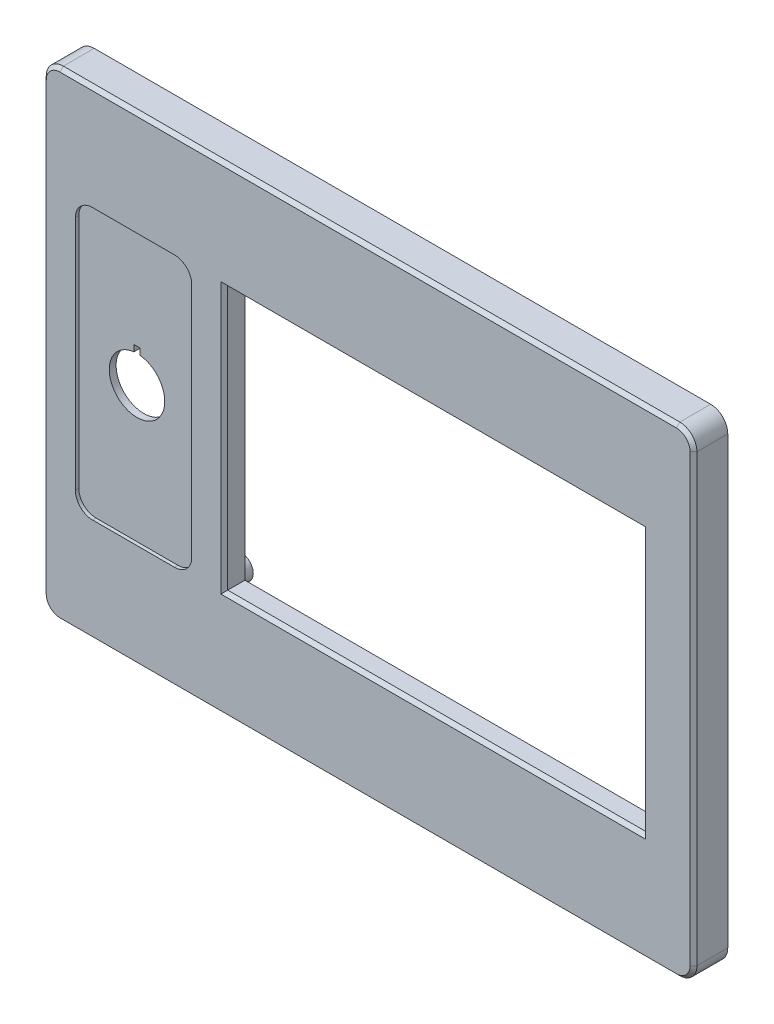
SolidWorks part; units mm, degrees
ref_plane "Front Plane" through (0, 0, 0) normal (0, 0, 1) x (1, 0, 0)
ref_plane "Top Plane" through (0, 0, 0) normal (0, 1, 0) x (1, 0, 0)
ref_plane "Right Plane" through (0, 0, 0) normal (1, 0, 0) x (0, 0, -1)
sketch "Sketch1" plane through (0, 0, 0) normal (0, 0, 1) x (1, 0, 0)
  line L0 (-90, -70) -> (90, -70) construction
  line L1 (95, -65) -> (95, 65) construction
  line L2 (90, 70) -> (-90, 70) construction
  line L3 (-95, 65) -> (-95, -65) construction
  line L4 (-90, -70) -> (90, -70)
  line L5 (95, -65) -> (95, 65)
  line L6 (90, 70) -> (-90, 70)
  line L7 (-95, 65) -> (-95, -65)
  line L8 (92, -65) -> (92, 65)
  line L9 (90, 67) -> (-90, 67)
  line L10 (-92, 65) -> (-92, -65)
  line L11 (-90, -67) -> (90, -67)
  arc A0 (-95, -65) -> (-90, -70) centre (-90, -65) ccw construction
  arc A1 (90, -70) -> (95, -65) centre (90, -65) ccw construction
  arc A2 (95, 65) -> (90, 70) centre (90, 65) ccw construction
  arc A3 (-90, 70) -> (-95, 65) centre (-90, 65) ccw construction
  arc A4 (-95, -65) -> (-90, -70) centre (-90, -65) ccw
  arc A5 (90, -70) -> (95, -65) centre (90, -65) ccw
  arc A6 (95, 65) -> (90, 70) centre (90, 65) ccw
  arc A7 (-90, 70) -> (-95, 65) centre (-90, 65) ccw
  arc A8 (92, 65) -> (90, 67) centre (90, 65) ccw
  arc A9 (-90, 67) -> (-92, 65) centre (-90, 65) ccw
  arc A10 (-92, -65) -> (-90, -67) centre (-90, -65) ccw
  arc A11 (90, -67) -> (92, -65) centre (90, -65) ccw
  dimension "D1" = 3
extrude "Boss-Extrude1" add sketch "Sketch1" along normal blind 10
sketch "Sketch2" plane through (0, 0, 10) normal (0, 0, 1) x (1, 0, 0)
  line L0 (95, -65) -> (95, 65) construction
  line L1 (-90, -70) -> (90, -70) construction
  line L2 (-95, 65) -> (-95, -65) construction
  line L3 (90, 70) -> (-90, 70) construction
  line L4 (95, -65) -> (95, 65)
  line L5 (-90, -70) -> (90, -70)
  line L6 (-95, 65) -> (-95, -65)
  line L7 (90, 70) -> (-90, 70)
  arc A0 (95, 65) -> (90, 70) centre (90, 65) ccw construction
  arc A1 (90, -70) -> (95, -65) centre (90, -65) ccw construction
  arc A2 (-95, -65) -> (-90, -70) centre (-90, -65) ccw construction
  arc A3 (-90, 70) -> (-95, 65) centre (-90, 65) ccw construction
  arc A4 (95, 65) -> (90, 70) centre (90, 65) ccw
  arc A5 (90, -70) -> (95, -65) centre (90, -65) ccw
  arc A6 (-95, -65) -> (-90, -70) centre (-90, -65) ccw
  arc A7 (-90, 70) -> (-95, 65) centre (-90, 65) ccw
extrude "Boss-Extrude2" add sketch "Sketch2" against normal blind 3
sketch "Sketch3" plane through (0, 0, 10) normal (0, 0, 1) x (1, 0, 0)
  line L0 (-95, 0) -> (95, 0) construction
  line L1 (-95, 65) -> (-95, -65) construction
  line L2 (95, -65) -> (95, 65) construction
  line L3 (-68.5, 0) -> (-68.5, 10.1635) construction
  line L4 (-46.05, 38.55) -> (84.05, 38.55) construction
  line L5 (-46.05, 38.55) -> (-46.05, -38.55) construction
  line L6 (-46.05, -38.55) -> (84.05, -38.55) construction
  line L7 (84.05, 38.55) -> (84.05, -38.55) construction
  line L8 (-46.05, 38.55) -> (84.05, -38.55) construction
  line L9 (-46.05, -38.55) -> (84.05, 38.55) construction
  line L10 (-49.5, 42) -> (87.5, 42) construction
  line L11 (-49.5, 42) -> (-49.5, -42) construction
  line L12 (-49.5, -42) -> (87.5, -42) construction
  line L13 (87.5, 42) -> (87.5, -42) construction
  line L14 (-49.5, 42) -> (87.5, -42) construction
  line L15 (-49.5, -42) -> (87.5, 42) construction
  line L16 (-42, 38.5) -> (80, 38.5)
  line L17 (-42, 38.5) -> (-42, -38.5)
  line L18 (-42, -38.5) -> (80, -38.5)
  line L19 (80, 38.5) -> (80, -38.5)
  line L20 (-42, 38.5) -> (80, -38.5) construction
  line L21 (-42, -38.5) -> (80, 38.5) construction
  line L22 (-69.4, 9.9) -> (-67.6, 9.9)
  line L23 (-69.4, 4.6101) -> (-67.6, 4.6101) construction
  line L24 (-69.4, 4.6101) -> (-69.4, 9.9) construction
  line L25 (-69.4, 9.9) -> (-67.6, 9.9) construction
  line L26 (-67.6, 4.6101) -> (-67.6, 9.9) construction
  line L27 (-69.4, 4.6101) -> (-67.6, 9.9) construction
  line L28 (-69.4, 9.9) -> (-67.6, 4.6101) construction
  line L29 (-67.6, 9.9) -> (-67.6, 8.0498)
  line L30 (-69.4, 9.9) -> (-69.4, 8.0498)
  arc A5 (-69.4, 8.0498) -> (-67.6, 8.0498) centre (-68.5, 0) ccw
  point P6 (19, 0)
  point P11 (19, 0)
  point P12 (19, 0)
  point P23 (-68.5, 7.255)
  point P29 (-68.5, -8.1)
  dimension "D7" = 16.2
  dimension "D8" = 26.5
  dimension "D9" = 18
  dimension "D10" = 1.8
  dimension "D1" = 130.1
  dimension "D2" = 77.1
  dimension "D3" = 137
  dimension "D4" = 84
  dimension "D5" = 77
  dimension "D6" = 122
  dimension "D11" = 114
extrude "Cut-Extrude1" cut sketch "Sketch3" against normal blind 3
sketch "Sketch4" plane through (0, 0, 7) normal (0, 0, -1) x (-1, 0, 0)
  circle A0 centre (-84.05, 38.55) radius 3.5
  circle A1 centre (-84.05, 38.55) radius 2
  circle A2 centre (46.05, 38.55) radius 3.5
  circle A3 centre (46.05, 38.55) radius 2
  circle A4 centre (46.05, -38.55) radius 3.5
  circle A5 centre (46.05, -38.55) radius 2
  circle A6 centre (-84.05, -38.55) radius 3.5
  circle A7 centre (-84.05, -38.55) radius 2
  dimension "D1" = 4
  dimension "D2" = 7
  dimension "D3" = 7
  dimension "D4" = 4
  dimension "D5" = 7
  dimension "D6" = 4
  dimension "D7" = 7
  dimension "D8" = 4
extrude "LCD Standoffs" add sketch "Sketch4" along normal blind 6
chamfer "Chamfer1" distance 1 angle 45 8 edges at (-95, 0, 10) (-93.5355, -68.5355, 10) (-93.5355, 68.5355, 10) (0, -70, 10) (0, 70, 10) (93.5355, -68.5355, 10) (93.5355, 68.5355, 10) (95, 0, 10)
sketch "Sketch5" plane through (0, 0, 7) normal (0, 0, -1) x (-1, 0, 0)
  line L0 (75, 67) -> (92, 50)
  line L3 (92, -50) -> (75, -67)
  line L4 (-90, -67) -> (90, -67)
  line L5 (92, -65) -> (92, 65)
  line L6 (90, 67) -> (-90, 67)
  line L7 (-92, 65) -> (-92, -65)
  line L8 (-90, -67) -> (-75, -67)
  line L9 (92, -65) -> (92, -50)
  line L10 (90, 67) -> (75, 67)
  line L11 (-92, 65) -> (-92, 50)
  line L13 (-92, -50) -> (-75, -67)
  line L15 (-75, 67) -> (-92, 50)
  line L16 (-92, -50) -> (-92, -65)
  line L17 (-75, 67) -> (-90, 67)
  line L18 (92, 50) -> (92, 65)
  line L19 (75, -67) -> (90, -67)
  line L20 (90, -70) -> (-90, -70) construction
  line L21 (-95, -65) -> (-95, 65) construction
  line L22 (95, 65) -> (95, -65) construction
  line L23 (-90, 70) -> (90, 70) construction
  arc A5 (-92, -65) -> (-90, -67) centre (-90, -65) ccw
  arc A6 (90, -67) -> (92, -65) centre (90, -65) ccw
  arc A7 (92, 65) -> (90, 67) centre (90, 65) ccw
  arc A8 (-90, 67) -> (-92, 65) centre (-90, 65) ccw
  arc A9 (-92, -65) -> (-90, -67) centre (-90, -65) ccw
  arc A10 (90, -67) -> (92, -65) centre (90, -65) ccw
  arc A11 (92, 65) -> (90, 67) centre (90, 65) ccw
  arc A12 (-90, 67) -> (-92, 65) centre (-90, 65) ccw
  dimension "D1" = 0
  dimension "D2" = 20
  dimension "D3" = 20
  dimension "D4" = 20
  dimension "D5" = 20
  dimension "D6" = 20
  dimension "D7" = 20
  dimension "D8" = 20
  dimension "D9" = 20
extrude "Boss-Extrude4" add sketch "Sketch5" along normal up to vertex (7 mm away)
sketch "Sketch6" plane through (0, 0, 0) normal (0, 0, -1) x (-1, 0, 0)
  line L0 (-93.5355, 68.5355) -> (-83.5, 58.5) construction
  line L1 (-92, 50) -> (-75, 67) construction
  line L2 (83.5, 58.5) -> (93.5355, 68.5355) construction
  line L3 (75, 67) -> (92, 50) construction
  line L4 (83.5, -58.5) -> (93.5355, -68.5355) construction
  line L5 (92, -50) -> (75, -67) construction
  line L6 (-93.5355, -68.5355) -> (-83.5, -58.5) construction
  line L7 (-75, -67) -> (-92, -50) construction
  circle A0 centre (89.5167, -64.5167) radius 2.85
  circle A1 centre (-89.5167, -64.5167) radius 2.85
  circle A2 centre (-89.5167, 64.5167) radius 2.85
  circle A3 centre (89.5167, 64.5167) radius 2.85
  arc A4 (-90, 70) -> (-95, 65) centre (-90, 65) ccw construction
  arc A5 (95, 65) -> (90, 70) centre (90, 65) ccw construction
  arc A6 (90, -70) -> (95, -65) centre (90, -65) ccw construction
  arc A7 (-95, -65) -> (-90, -70) centre (-90, -65) ccw construction
  dimension "D1" = 5.7
  dimension "D2" = 5.7
  dimension "D3" = 5.7
  dimension "D4" = 5.7
extrude "Cut-Extrude2" cut sketch "Sketch6" against normal blind 6.5
chamfer "LCD chamfer" distance 1 angle 45 4 edges at (19, 38.5, 10) (80, 0, 10) (19, -38.5, 10) (-42, 0, 10)
sketch "Sketch9" plane through (0, 0, 7) normal (0, 0, -1) x (-1, 0, 0)
  line L0 (-80, 38.5) -> (-80, -38.5) construction
  line L1 (42, 38.5) -> (-80, 38.5) construction
  line L2 (42, 38.5) -> (42, -38.5) construction
  line L3 (42, -38.5) -> (-80, -38.5) construction
  line L4 (-80, 38.5) -> (-80, -38.5)
  line L5 (42, 38.5) -> (-80, 38.5)
  line L6 (42, 38.5) -> (42, -38.5)
  line L7 (42, -38.5) -> (-80, -38.5)
  line L8 (44, -40.5) -> (-82, -40.5)
  line L9 (-82, 40.5) -> (-82, -40.5)
  line L10 (44, 40.5) -> (-82, 40.5)
  line L11 (44, 40.5) -> (44, -40.5)
  dimension "D1" = 2
extrude "Boss-Extrude6" add sketch "Sketch9" along normal blind 3
sketch "Sketch10" plane through (0, 0, 0) normal (0, 0, -1) x (-1, 0, 0)
  line L0 (75, 67) -> (92, 50) construction
  line L1 (92, 50) -> (92, -50) construction
  line L2 (92, -50) -> (75, -67) construction
  line L3 (75, -67) -> (-75, -67) construction
  line L4 (-75, -67) -> (-92, -50) construction
  line L5 (-92, -50) -> (-92, 50) construction
  line L6 (-75, 67) -> (75, 67) construction
  line L7 (-92, 50) -> (-75, 67) construction
  line L8 (75, 67) -> (92, 50)
  line L9 (92, 50) -> (92, -50)
  line L10 (92, -50) -> (75, -67)
  line L11 (75, -67) -> (-75, -67)
  line L12 (-75, -67) -> (-92, -50)
  line L13 (-92, -50) -> (-92, 50)
  line L14 (-75, 67) -> (75, 67)
  line L15 (-92, 50) -> (-75, 67)
  line L17 (93.65, 50.6835) -> (93.65, -50.6835)
  line L19 (75.6835, -68.65) -> (-75.6835, -68.65)
  line L21 (-93.65, -50.6835) -> (-93.65, 50.6835)
  line L23 (-75.6835, 68.65) -> (75.6835, 68.65)
  line L24 (-93.65, 50.6835) -> (-75.6835, 68.65) construction
  line L25 (-75.6835, -68.65) -> (-93.65, -50.6835) construction
  line L26 (93.65, -50.6835) -> (75.6835, -68.65) construction
  line L27 (75.6835, 68.65) -> (93.65, 50.6835) construction
  line L28 (75.6835, 68.65) -> (79.7542, 68.65)
  line L29 (79.7542, 68.65) -> (93.65, 54.7542)
  line L30 (93.65, 54.7542) -> (93.65, 50.6835)
  line L31 (-75.6835, 68.65) -> (-79.7542, 68.65)
  line L32 (-79.7542, 68.65) -> (-93.65, 54.7542)
  line L33 (-93.65, 54.7542) -> (-93.65, 50.6835)
  line L34 (-93.65, -50.6835) -> (-93.65, -54.7542)
  line L35 (-93.65, -54.7542) -> (-79.7542, -68.65)
  line L36 (-79.7542, -68.65) -> (-75.6835, -68.65)
  line L37 (93.65, -50.6835) -> (93.65, -54.7542)
  line L38 (75.6835, -68.65) -> (79.7542, -68.65)
  line L39 (79.7542, -68.65) -> (93.65, -54.7542)
  line L40 (-93.5, 54.6213) -> (-79.6213, 68.5) construction
  line L41 (79.6213, 68.5) -> (93.5, 54.6213) construction
  line L44 (93.5, -54.6213) -> (79.6213, -68.5) construction
  line L45 (-79.6213, -68.5) -> (-93.5, -54.6213) construction
  dimension "D2" = 0.2
  dimension "D3" = 0.2
  dimension "D4" = 0.2
  dimension "D5" = 0.2
  dimension "D1" = 1.65
extrude "Cut-Extrude4" cut sketch "Sketch10" against normal blind 1.6
sketch "Sketch11" plane through (0, 0, 10) normal (0, 0, 1) x (1, 0, 0)
  line L0 (81, -39.5) -> (-43, -39.5) construction
  line L1 (-80.4842, 39.5) -> (-56.5158, 39.5)
  line L2 (-85.4842, 34.5) -> (-85.4842, -34.5)
  line L3 (-80.4842, -39.5) -> (-56.5158, -39.5)
  line L4 (-51.5158, 34.5) -> (-51.5158, -34.5)
  line L5 (-85.4842, 39.5) -> (-51.5158, -39.5) construction
  line L6 (-85.4842, -39.5) -> (-51.5158, 39.5) construction
  line L7 (-67.6, 9.9) -> (-69.4, 9.9) construction
  line L8 (-69.4, 9.9) -> (-69.4, 8.0498) construction
  line L9 (-67.6, 8.0498) -> (-67.6, 9.9) construction
  line L10 (-67.6, 9.9) -> (-69.4, 9.9)
  line L11 (-69.4, 9.9) -> (-69.4, 8.0498)
  line L12 (-67.6, 8.0498) -> (-67.6, 9.9)
  arc A0 (-56.5158, 39.5) -> (-51.5158, 34.5) centre (-56.5158, 34.5) cw
  arc A1 (-80.4842, 39.5) -> (-85.4842, 34.5) centre (-80.4842, 34.5) ccw
  arc A2 (-85.4842, -34.5) -> (-80.4842, -39.5) centre (-80.4842, -34.5) ccw
  arc A3 (-56.5158, -39.5) -> (-51.5158, -34.5) centre (-56.5158, -34.5) ccw
  arc A4 (-69.4, 8.0498) -> (-67.6, 8.0498) centre (-68.5, 0) ccw construction
  arc A5 (-69.4, 8.0498) -> (-67.6, 8.0498) centre (-68.5, 0) ccw
  point P0 (-68.5, 0)
  dimension "D1" = 5
extrude "Cut-Extrude5" cut sketch "Sketch11" against normal blind 1
sketch "Sketch12" plane through (0, 0, 7) normal (0, 0, -1) x (-1, 0, 0)
  line L0 (92, 0) -> (42, 0) construction
  line L1 (92, -50) -> (92, 50) construction
  line L2 (42, -38.5) -> (42, 38.5) construction
  line L3 (44, -35.7132) -> (44, 35.7132) construction
  line L4 (44, -15) -> (92, -15)
  line L5 (44, -15) -> (44, -18)
  line L6 (44, -18) -> (92, -18)
  line L7 (92, -15) -> (92, -18)
  line L8 (43.1435, 40.5) -> (-81.1435, 40.5) construction
  line L9 (44, 18) -> (92, 18)
  line L10 (44, 18) -> (44, 15)
  line L11 (44, 15) -> (92, 15)
  line L12 (92, 18) -> (92, 15)
  line L13 (21, 40.5) -> (18, 40.5)
  line L14 (21, 40.5) -> (21, 67)
  line L15 (21, 67) -> (18, 67)
  line L16 (18, 40.5) -> (18, 67)
  line L17 (75, 67) -> (-75, 67) construction
  line L18 (-81.1435, -40.5) -> (43.1435, -40.5) construction
  line L19 (-52, 40.5) -> (-55, 40.5)
  line L20 (-52, 40.5) -> (-52, 67)
  line L21 (-52, 67) -> (-55, 67)
  line L22 (-55, 40.5) -> (-55, 67)
  line L23 (-55, -40.5) -> (-52, -40.5)
  line L24 (-55, -40.5) -> (-55, -67)
  line L25 (-55, -67) -> (-52, -67)
  line L26 (-52, -40.5) -> (-52, -67)
  line L27 (-75, -67) -> (75, -67) construction
  line L28 (-95, -65) -> (-95, 65) construction
  line L29 (18, -40.5) -> (21, -40.5)
  line L30 (18, -40.5) -> (18, -67)
  line L31 (18, -67) -> (21, -67)
  line L32 (21, -40.5) -> (21, -67)
  line L33 (-82, 35.7132) -> (-82, -35.7132) construction
  line L34 (-82, 15) -> (-92, 15)
  line L35 (-82, 15) -> (-82, 18)
  line L36 (-82, 18) -> (-92, 18)
  line L37 (-92, 15) -> (-92, 18)
  line L38 (-92, 50) -> (-92, -50) construction
  line L40 (-82, -18) -> (-92, -18)
  line L41 (-82, -18) -> (-82, -15)
  line L42 (-82, -15) -> (-92, -15)
  line L43 (-92, -18) -> (-92, -15)
  dimension "D1" = 3
  dimension "D2" = 15
  dimension "D3" = 15
  dimension "D4" = 3
  dimension "D5" = 3
  dimension "D6" = 3
  dimension "D7" = 3
  dimension "D8" = 3
  dimension "D9" = 40
  dimension "D10" = 70
extrude "Boss-Extrude7" add sketch "Sketch12" along normal up to surface (3 mm away)
fillet "Fillet1" radius 3 40 edges at (-44, 15, 5.5) (-44, -18, 5.5) (-92, 15, 5.5) (-92, -18, 5.5) (-92, -15, 5.5) (-44, -15, 5.5) (-44, 18, 5.5) (-92, 18, 5.5) (-43.1435, 40.5, 5.5) (-44, 35.7132, 5.5) (-44, -35.7132, 5.5) (-43.1435, -40.5, 5.5) (-21, -40.5, 5.5) (-21, -67, 5.5) (-18, -67, 5.5) (-18, -40.5, 5.5) (52, -40.5, 5.5) (52, -67, 5.5) (55, -67, 5.5) (55, -40.5, 5.5) (81.1435, -40.5, 5.5) (82, -35.7132, 5.5) (82, 35.7132, 5.5) (81.1435, 40.5, 5.5) (55, 40.5, 5.5) (55, 67, 5.5) (52, 67, 5.5) (52, 40.5, 5.5) (-18, 40.5, 5.5) (-18, 67, 5.5) (-21, 40.5, 5.5) (-21, 67, 5.5) (82, -18, 5.5) (92, -18, 5.5) (92, -15, 5.5) (82, -15, 5.5) (82, 15, 5.5) (92, 18, 5.5) (82, 18, 5.5) (92, 15, 5.5)
